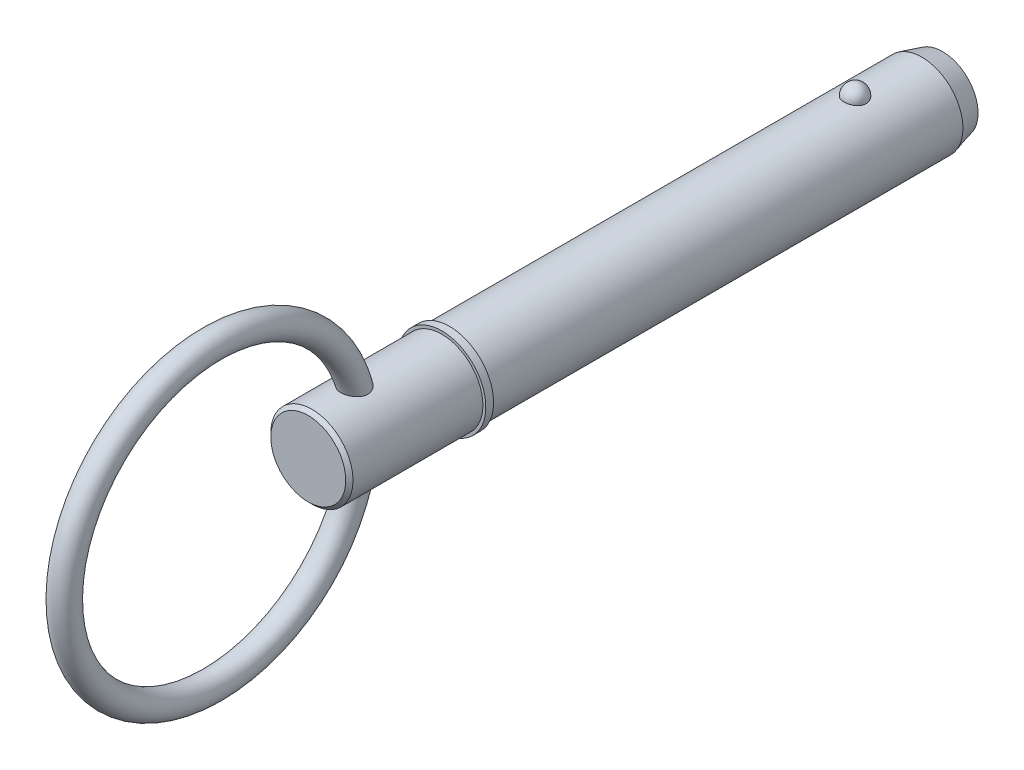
SolidWorks part; units mm, degrees
ref_plane "Front Plane" through (0, 0, 0) normal (0, 0, 1) x (1, 0, 0)
ref_plane "Top Plane" through (0, 0, 0) normal (0, 1, 0) x (1, 0, 0)
ref_plane "Right Plane" through (0, 0, 0) normal (1, 0, 0) x (0, 0, -1)
sketch "Sketch2" plane through (0, 0, 0) normal (0, 0, 1) x (1, 0, 0)
  circle A0 centre (0, 0) radius 7.94
  point P3 (0, 7.94)
  dimension "D1" = 15.88
extrude "Boss-Extrude1" add sketch "Sketch2" along normal blind 76.2
sketch "Sketch3" plane through (0, 0, 0) normal (0, 0, -1) x (-1, 0, 0)
  circle A0 centre (0, 0) radius 7.94
  dimension "D1" = 15.88
extrude "Boss-Extrude2" add sketch "Sketch3" along normal blind 19.05
chamfer "Chamfer1" distance 4 angle 15 1 edges at (-7.94, 0, -19.05)
sketch "Sketch18" plane through (0, 0, 0) normal (1, 0, 0) x (0, 0, -1)
  line L0 (15.05, 7.94) -> (-76.2, 7.94) construction
  line L1 (2.15, 10.09) -> (2.15, 5.79)
  line L2 (-76.2, -7.94) -> (15.05, -7.94) construction
  arc A0 (2.15, 10.09) -> (2.15, 5.79) centre (2.15, 7.94) ccw
  point P4 (0, 7.94)
  dimension "D1" = 18.03
revolve "Revolve1" add sketch "Sketch18" angle 360 about L1
sketch "Sketch19" plane through (0, 0, 0) normal (1, 0, 0) x (0, 0, -1)
  line L0 (-33.7288, 0) -> (-46.4542, 0) construction
sketch "Sketch20" plane through (0, 0, 0) normal (1, 0, 0) x (0, 0, -1)
  line L0 (-76.2, 0) -> (-76.2, 8.5)
  line L1 (-76.2, 7.94) -> (-76.2, -7.94) construction
  line L2 (-76.2, 8.5) -> (-77.7, 8.5)
  line L3 (-77.7, 8.5) -> (-77.7, 0)
  line L4 (-33.7288, 0) -> (-46.4542, 0) construction
  line L5 (-77.7, 0) -> (-76.2, 0)
  dimension "D1" = 8.5
  dimension "D2" = 1.5
revolve "Revolve2" add sketch "Sketch20" angle 360 about L0
sketch "Sketch21" plane through (0, 0, 76.2) normal (0, 0, -1) x (-1, 0, 0)
  circle A0 centre (0, 0) radius 7.94
  dimension "D1" = 15.88
extrude "Boss-Extrude3" add sketch "Sketch21" against normal blind 27.31
chamfer "Chamfer2" distance 0.7 angle 45 1 edges at (-7.94, 0, 103.51)
sketch "Sketch23" plane through (0, 0, 0) normal (1, 0, 0) x (0, 0, -1)
  line L0 (-103.51, 7.24) -> (-103.51, -7.24) construction
  circle A0 centre (-122.085, 0) radius 28.575
  point P2 (-93.51, 0)
  dimension "D1" = 57.15
  dimension "D2" = 10
sketch "Sketch24" plane through (0, 0, 0) normal (0, 1, 0) x (1, 0, 0)
  circle A0 centre (0, -93.51) radius 2.5
  dimension "D1" = 5
sweep "Sweep1" add profiles "Sketch24" path "Sketch23"
